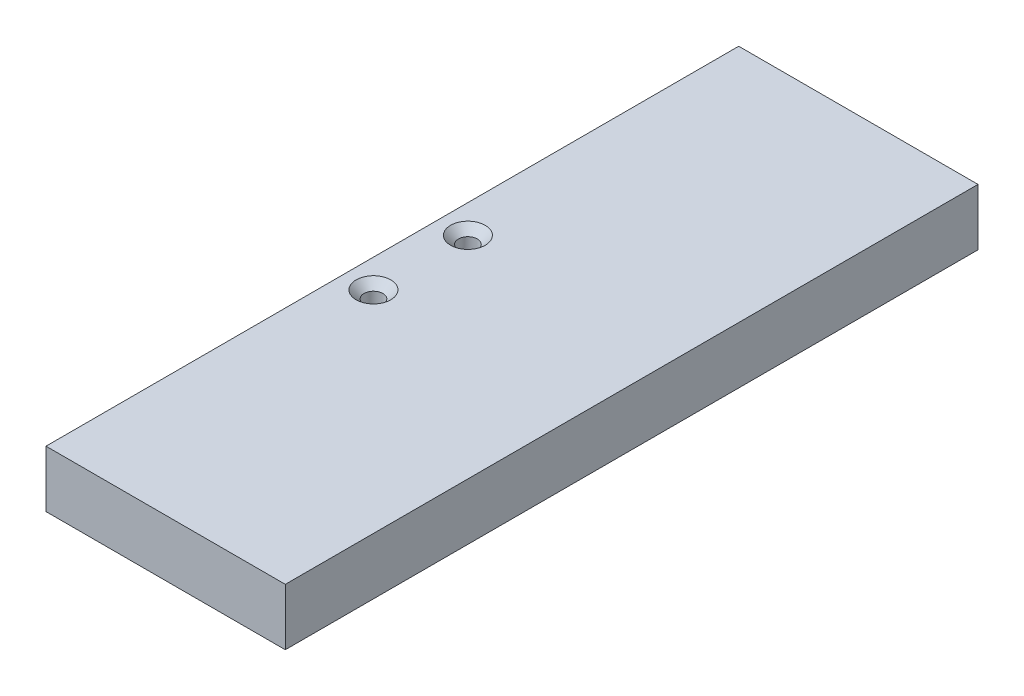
SolidWorks part; units mm, degrees
ref_plane "Plan de face" through (0, 0, 0) normal (0, 0, 1) x (1, 0, 0)
ref_plane "Plan de dessus" through (0, 0, 0) normal (0, 1, 0) x (1, 0, 0)
ref_plane "Plan de droite" through (0, 0, 0) normal (1, 0, 0) x (0, 0, -1)
sketch "Esquisse1" plane through (0, 0, 0) normal (0, 0, 1) x (1, 0, 0)
  line L0 (-19, 4.5) -> (19, -4.5) construction
  line L1 (-19, 4.5) -> (19, 4.5)
  line L2 (-19, 4.5) -> (-19, -4.5)
  line L3 (-19, -4.5) -> (19, -4.5)
  line L4 (19, 4.5) -> (19, -4.5)
  dimension "D1" = 38
  dimension "D2" = 9
extrude "Boss.-Extru.1" add sketch "Esquisse1" along normal mid plane 110
sketch "Esquisse2" plane through (0, 4.5, 0) normal (0, 1, 0) x (1, 0, 0)
  line L0 (0, 0) -> (-19, 0) construction
  line L1 (-19, -55) -> (-19, 55) construction
  line L2 (-14.5, 7.5) -> (-14.5, -7.5) construction
  circle A0 centre (-14.5, 7.5) radius 1.5
  circle A1 centre (-14.5, -7.5) radius 1.5
  point P7 (-14.5, 0)
  dimension "D3" = 3
  dimension "D1" = 15
  dimension "D2" = 4.5
extrude "Enlèv. mat.-Extru.1" cut sketch "Esquisse2" against normal up to next
chamfer "Chanfrein1" distance 1.25 angle 45 4 edges at (-14.5, -4.5, 9) (-14.5, -4.5, -6) (-14.5, 4.5, 9) (-14.5, 4.5, -6)
